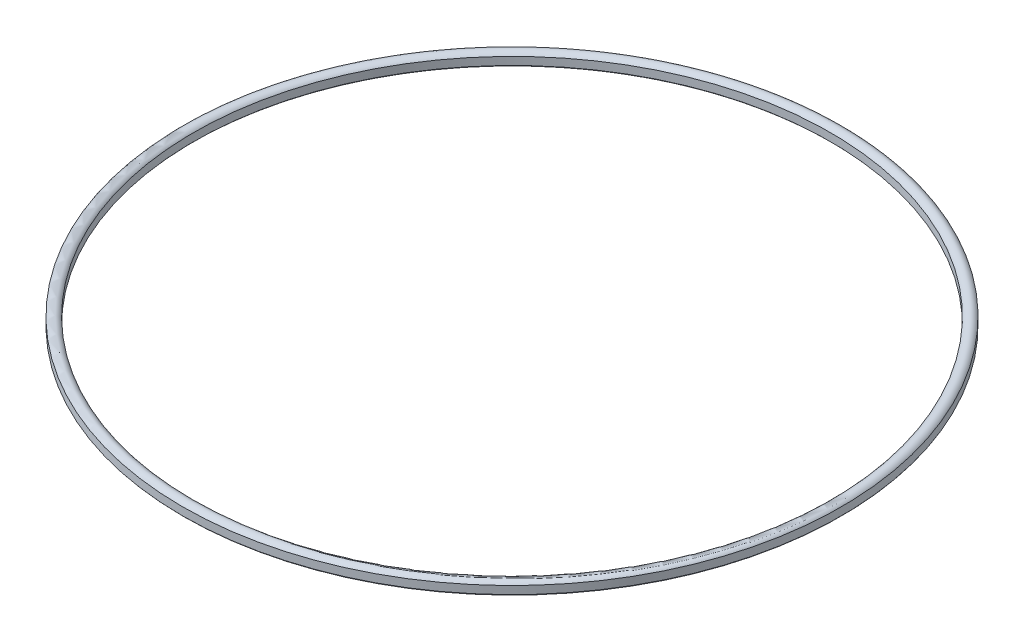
SolidWorks part; units mm, degrees
ref_plane "Front Plane" through (0, 0, 0) normal (0, 0, 1) x (1, 0, 0)
ref_plane "Top Plane" through (0, 0, 0) normal (0, 1, 0) x (1, 0, 0)
ref_plane "Right Plane" through (0, 0, 0) normal (1, 0, 0) x (0, 0, -1)
sketch "Sketch1" plane through (0, 0, 0) normal (0, 0, 1) x (1, 0, 0)
  line L0 (0, 25.6201) -> (0, -23.8009) construction
  line L1 (-125.222, -1.5481) -> (-125.222, 1.5481)
  line L2 (-14.6766, 0) -> (-10.372, 0) construction
  line L3 (-127.3937, 0) -> (-127.3937, 6.6221) construction
  line L4 (-129.5654, -1.5481) -> (-129.5654, 1.5481)
  arc A0 (-125.222, 1.5481) -> (-129.5654, 1.5481) centre (-127.3937, 0) ccw
  arc A1 (-129.5654, -1.5481) -> (-125.222, -1.5481) centre (-127.3937, 0) ccw
  dimension "D1" = 125.222
  dimension "D2" = 5.334
  dimension "D3" = 4.3434
revolve "Revolve1" add sketch "Sketch1" angle 360 about L0
